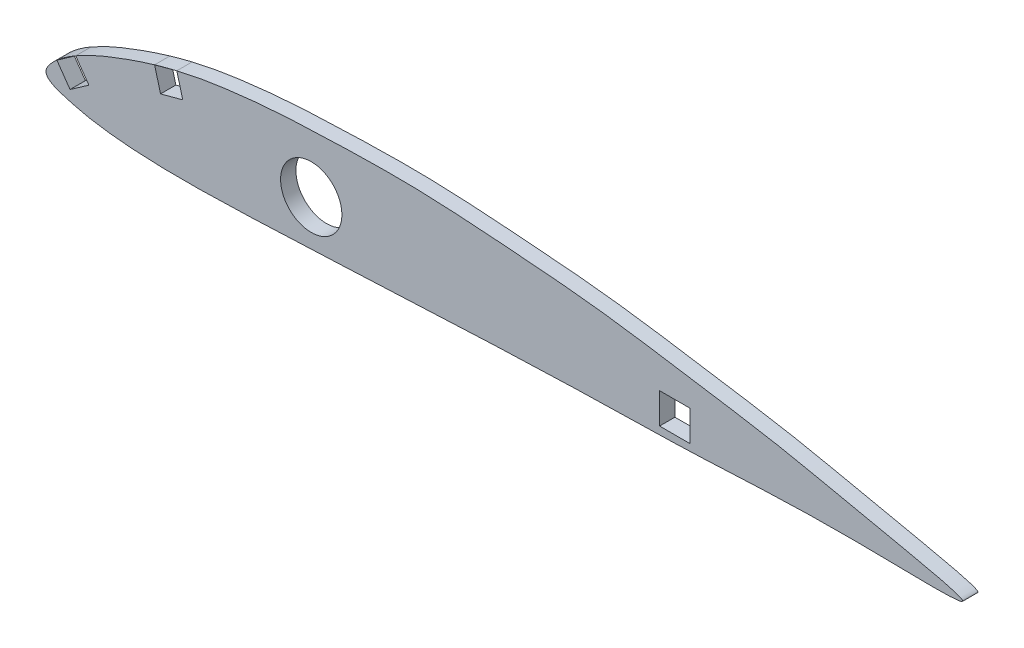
SolidWorks part; units mm, degrees
ref_plane "Front Plane" through (0, 0, 0) normal (0, 0, 1) x (1, 0, 0)
ref_plane "Top Plane" through (0, 0, 0) normal (0, 1, 0) x (1, 0, 0)
ref_plane "Right Plane" through (0, 0, 0) normal (1, 0, 0) x (0, 0, -1)
sketch3d "3DSketch1"
  spline S1 degree 3 poles (4.9191, -2.9212, 0) (-1.8176, -0.7988, 0) (2.166, 3.2964, 0) (5.3167, 5.5529, 0) (9.4002, 7.7518, 0) (17.2202, 10.9328, 0) (26.7064, 13.9594, 0) (37.9354, 15.7551, 0) (47.4526, 16.7049, 0) (60.1209, 17.2358, 0) (75.9723, 17.6854, 0) (94.9441, 16.3539, 0) (114.0529, 14.8649, 0) (132.7281, 11.8733, 0) (152.7615, 8.8107, 0) (168.0503, 5.2139, 0) (200.5952, -1.2326, 0) (158.4854, 0.2506, 0) (140.1729, -1.4253, 0) (100.6411, -2.0485, 0) (69.7392, -3.7323, 0) (37.9229, -5.1191, 0) (22.2869, -5.3755, 0) (10.7781, -4.2608, 0) (4.9191, -2.9212, 0) (-1.8176, -0.7988, 0) (2.166, 3.2964, 0) knots -0.051806 -0.027094 -0.014492 0 0.01056 0.018211 0.03221 0.045525 0.084069 0.108974 0.133649 0.158233 0.207343 0.256523 0.305826 0.355445 0.405214 0.45539 0.506007 0.555122 0.65337 0.70249 0.849939 0.899083 0.948194 0.972906 0.985508 1 1.01056 1.018211 1.03221 only from (0, 0, 0) to (0, 0, 0)
  dimension "D1" = 189.88
extrude "Boss-Extrude1" add sketch "3DSketch1" along direction (0, 0, 1) on the side of the normal blind 3.175
sketch "Sketch1" plane through (0, 0, 3.175) normal (0, 0, 1) x (1, 0, 0)
  line L0 (0, 0) -> (189.88, 0) construction
  line L1 (94.94, 0) -> (94.94, 5) construction
  line L2 (94.94, 5) -> (54.94, 5) construction
  line L3 (2.2507, 3.2159) -> (6.1519, 5.9476)
  line L4 (127.097, 6.35) -> (133.447, 6.35)
  line L5 (127.097, 6.35) -> (127.097, 0)
  line L6 (127.097, 0) -> (133.447, 0)
  line L7 (133.447, 6.35) -> (133.447, 0)
  line L8 (2.2507, 3.2159) -> (4.9824, -0.6853)
  line L9 (6.1519, 5.9476) -> (8.8836, 2.0464)
  line L10 (4.9824, -0.6853) -> (8.8836, 2.0464)
  line L11 (22.4932, 12.4987) -> (27.0935, 13.7313)
  line L12 (22.4932, 12.4987) -> (23.7259, 7.8985)
  line L13 (27.0935, 13.7313) -> (28.3261, 9.1311)
  line L14 (23.7259, 7.8985) -> (28.3261, 9.1311)
  circle A0 centre (54.94, 5) radius 6.35
  spline S0 degree 3 poles (2.166, 3.2964) (-1.8176, -0.7988) (4.9191, -2.9212) (10.7781, -4.2608) (22.2869, -5.3755) (37.9229, -5.1191) (69.7392, -3.7323) (100.6411, -2.0485) (140.1729, -1.4253) (158.4854, 0.2506) (200.5952, -1.2326) (168.0503, 5.2139) (152.7615, 8.8107) (132.7281, 11.8733) (114.0529, 14.8649) (94.9441, 16.3539) (75.9723, 17.6854) (60.1209, 17.2358) (47.4526, 16.7049) (37.9354, 15.7551) (26.7064, 13.9594) (17.2202, 10.9328) (9.4002, 7.7518) (5.3167, 5.5529) (2.166, 3.2964) (-1.8176, -0.7988) (4.9191, -2.9212) knots -0.03221 -0.018211 -0.01056 0 0.014492 0.027094 0.051806 0.100917 0.150061 0.29751 0.34663 0.444878 0.493993 0.54461 0.594786 0.644555 0.694174 0.743477 0.792657 0.841767 0.866351 0.891026 0.915931 0.954475 0.96779 0.981789 0.98944 1 1.014492 1.027094 1.051806 only from (0, 0) to (0, 0) construction
  dimension "D3" = 32.157
  dimension "D1" = 40
  dimension "D2" = 5
  dimension "D4" = 6.35
  dimension "D5" = 6.35
  dimension "D6" = 4.7625
  dimension "D7" = 4.7625
  dimension "D8" = 55
  dimension "D9" = 4.7625
  dimension "D10" = 4.7625
  dimension "D11" = 75
extrude "Cut-Extrude1" cut sketch "Sketch1" against normal blind 10
